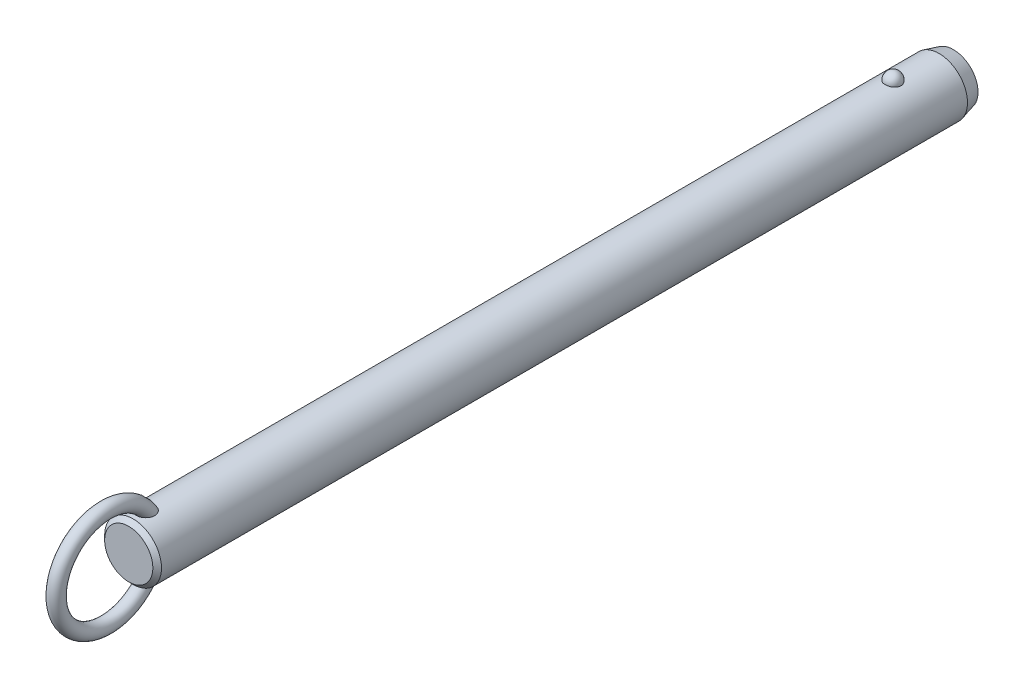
SolidWorks part; units mm, degrees
ref_plane "Front Plane" through (0, 0, 0) normal (0, 0, 1) x (1, 0, 0)
ref_plane "Top Plane" through (0, 0, 0) normal (0, 1, 0) x (1, 0, 0)
ref_plane "Right Plane" through (0, 0, 0) normal (1, 0, 0) x (0, 0, -1)
sketch "Sketch2" plane through (0, 0, 0) normal (0, 0, 1) x (1, 0, 0)
  circle A0 centre (0, 0) radius 7.9
  point P3 (0, 7.9)
  dimension "D1" = 15.8
extrude "Boss-Extrude1" add sketch "Sketch2" along normal blind 200.7
sketch "Sketch3" plane through (0, 0, 0) normal (0, 0, -1) x (-1, 0, 0)
  circle A0 centre (0, 0) radius 7.9
  dimension "D1" = 15.8
extrude "Boss-Extrude2" add sketch "Sketch3" along normal blind 19
chamfer "Chamfer1" distance 4 angle 15 1 edges at (-7.9, 0, -19)
sketch "Sketch12" plane through (0, 0, 0) normal (1, 0, 0) x (0, 0, -1)
  line L0 (-200.7, 7.9) -> (-200.7, -7.9) construction
  point P0 (-200.7, 0)
sketch "Sketch13" plane through (0, 0, 0) normal (1, 0, 0) x (0, 0, -1)
  circle A0 centre (-216.55, 0) radius 15.85
  point P2 (-200.7, 0)
  dimension "D1" = 31.7
sketch "Sketch14" plane through (0, 0, 0) normal (0, 1, 0) x (1, 0, 0)
  circle A0 centre (0, -202.7) radius 2
  point P2 (0, -200.7)
  dimension "D1" = 4
sweep "Sweep1" add profiles "Sketch14" path "Sketch13"
sketch "Sketch15" plane through (0, 0, 200.7) normal (0, 0, 1) x (1, 0, 0)
  circle A0 centre (0, 0) radius 7.9
  dimension "D1" = 15.8
extrude "Boss-Extrude3" add sketch "Sketch15" along normal blind 9.52
chamfer "Chamfer2" distance 1.2 angle 45 1 edges at (7.9, 0, 210.22)
sketch "Sketch18" plane through (0, 0, 0) normal (1, 0, 0) x (0, 0, -1)
  line L0 (15, 7.9) -> (-202.8091, 7.9) construction
  line L1 (2.2, 10.1) -> (2.2, 5.7)
  line L2 (-202.8091, -7.9) -> (15, -7.9) construction
  arc A0 (2.2, 10.1) -> (2.2, 5.7) centre (2.2, 7.9) ccw
  point P4 (0, 7.9)
  dimension "D1" = 18
revolve "Revolve1" add sketch "Sketch18" angle 360 about L1
